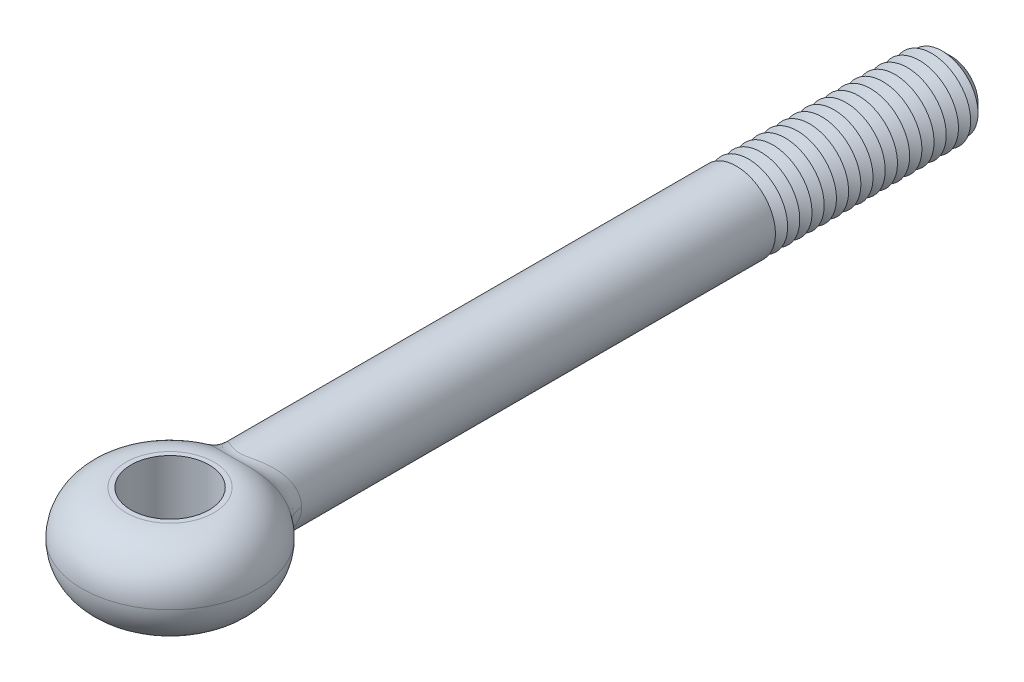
SolidWorks part; units mm, degrees
ref_plane "Front Plane" through (0, 0, 0) normal (0, 0, 1) x (1, 0, 0)
ref_plane "Top Plane" through (0, 0, 0) normal (0, 1, 0) x (1, 0, 0)
ref_plane "Right Plane" through (0, 0, 0) normal (1, 0, 0) x (0, 0, -1)
sketch "Sketch7" plane through (0, 0, 0) normal (0, 1, 0) x (1, 0, 0)
  circle A0 centre (0, 0) radius 9
  dimension "D1" = 18
extrude "Boss-Extrude3" add sketch "Sketch7" along normal mid plane 9
sketch "Sketch8" plane through (0, 0, 0) normal (0, 0, 1) x (1, 0, 0)
  circle A0 centre (0, 0) radius 4
  dimension "D1" = 8
extrude "Boss-Extrude4" add sketch "Sketch8" against normal blind 80
fillet "Fillet5" radius 4.5 2 edges at (0, -4.5, 9) (0, 4.5, 9)
fillet "Fillet6" radius 2.5 2 edges at (0.3214, -3.9871, -6.5786) (-0.3214, 3.9871, -6.5786)
chamfer "Chamfer1" distance 1.25 angle 45 1 edges at (4, 0, -80)
sketch "Sketch10" plane through (0, 0, 0) normal (0, 1, 0) x (1, 0, 0)
  line L0 (0, 28.1405) -> (0, -7.9233) construction
sketch "Sketch11" plane through (0, 0, 0) normal (0, 1, 0) x (1, 0, 0)
  line L0 (-4, 58) -> (-2.9175, 58.625)
  line L1 (-4, 78.75) -> (-4, 9.4868) construction
  line L2 (-2.9175, 58.625) -> (-4, 59.25)
  line L3 (-4, 59.25) -> (-4, 58)
  line L4 (2.75, 80) -> (-2.75, 80) construction
  dimension "D1" = 1.25
  dimension "D2" = 22
revolve "Cut-Revolve1" cut sketch "Sketch11" angle 360 about L0
pattern_linear "LPattern1" count 17 spacing 1.25 along (0, 0, -1) of "Cut-Revolve1"
sketch "Sketch12" plane through (0, 0, 0) normal (0, 1, 0) x (1, 0, 0)
  circle A0 centre (0, 0) radius 4
  dimension "D1" = 8
extrude "Cut-Extrude1" cut sketch "Sketch12" against normal mid plane 9
